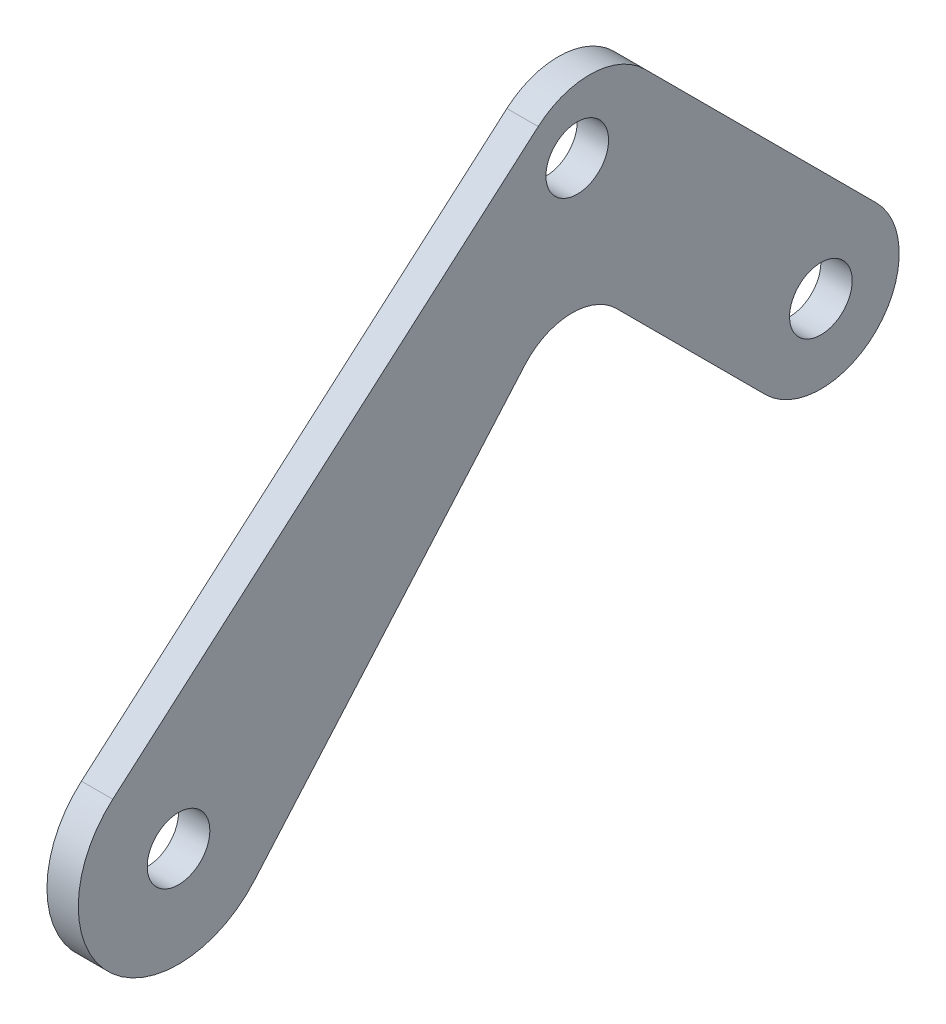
SolidWorks part; units mm, degrees
ref_plane "Front Plane" through (0, 0, 0) normal (0, 0, 1) x (1, 0, 0)
ref_plane "Top Plane" through (0, 0, 0) normal (0, 1, 0) x (1, 0, 0)
ref_plane "Right Plane" through (0, 0, 0) normal (1, 0, 0) x (0, 0, -1)
sketch "Sketch1" plane through (0, 0, 0) normal (1, 0, 0) x (0, 0, -1)
  line L0 (0, 0) -> (40.4112, 40.4112) construction
  line L1 (40.4112, 40.4112) -> (65.1069, 15.7154) construction
  line L2 (0, 0) -> (71.7264, 0) construction
  line L3 (47.2743, 44.7734) -> (70.7195, 21.3281)
  line L4 (59.4942, 10.1028) -> (44.382, 25.215)
  line L5 (35.0994, 24.8909) -> (7.6678, -6.6656)
  line L6 (-6.6656, 7.6678) -> (36.4541, 45.1512)
  line L7 (7.6678, -6.6656) -> (35.5835, 21.2501) construction
  arc A0 (70.7195, 21.3281) -> (59.4942, 10.1028) centre (65.1069, 15.7154) cw
  arc A1 (7.6678, -6.6656) -> (-6.6656, 7.6678) centre (0, 0) cw
  arc A2 (36.4541, 45.1512) -> (47.2743, 44.7734) centre (41.6616, 39.1607) cw
  arc A3 (44.382, 25.215) -> (35.0994, 24.8909) centre (39.8918, 20.7249) ccw
  point P16 (40.4112, 40.4112)
  point P17 (65.1069, 15.7154)
  dimension "D5" = 10.16
  dimension "D6" = 7.9375
  dimension "D7" = 7.9375
  dimension "D8" = 6.35
  dimension "D1" = 57.15
  dimension "D2" = 34.925
  dimension "D3" = 45
  dimension "D4" = 4
extrude "Extrude1" add sketch "Sketch1" along normal mid plane 3.175
other "Hole1"
sketch "Sketch2" plane through (1.5875, 0, 0) normal (1, 0, 0) x (0, 0, -1)
  circle A0 centre (0, 0) radius 3.175
  dimension "D1" = 6.35
pattern_sketch "Sketch-Pattern1" of "Hole1"
